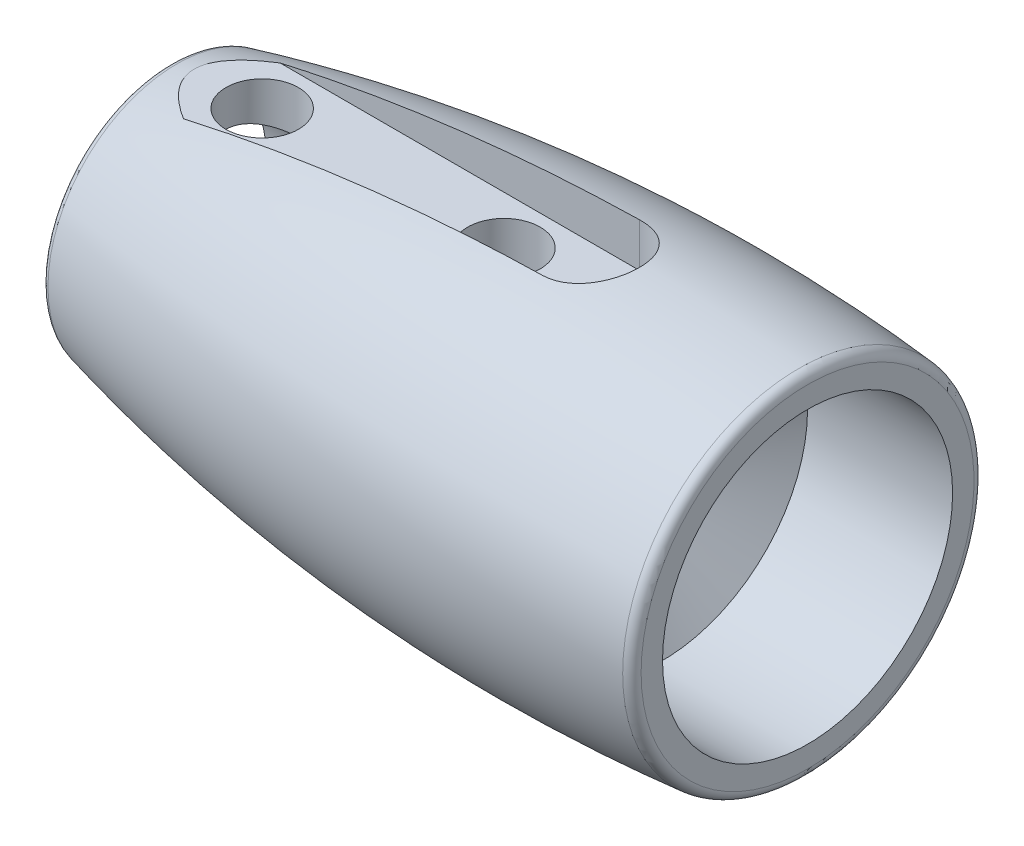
SolidWorks part; units mm, degrees
ref_plane "Plan de face" through (0, 0, 0) normal (0, 0, 1) x (1, 0, 0)
ref_plane "Plan de dessus" through (0, 0, 0) normal (0, 1, 0) x (1, 0, 0)
ref_plane "Plan de droite" through (0, 0, 0) normal (1, 0, 0) x (0, 0, -1)
sketch "Esquisse1" plane through (0, 0, 0) normal (0, 0, 1) x (1, 0, 0)
  line L0 (0, 0) -> (64.5142, 0) construction
  line L1 (8.9334, 6.5625) -> (8.9334, 5)
  line L3 (41.9334, 9.0625) -> (41.9334, 5)
  line L4 (8.9334, 5) -> (41.9334, 5)
  arc A0 (41.9334, 9.0625) -> (8.9334, 6.5625) centre (32.695, -88.0405) ccw
  ellipse E0 centre (32.2571, 0) end of major axis (0, 0) minor radius 9.5 (41.9334, 9.0625) -> (8.9334, 6.5625) ccw construction
  dimension "D1" = 10
  dimension "D2" = 13.125
  dimension "D3" = 18.125
  dimension "D4" = 33
  dimension "D6" = 19
revolve "Révolution1" add sketch "Esquisse1" angle 360 about L0
ref_plane "Plan1" through (0, 6.875, 0) normal (0, 1, 0) x (-1, 0, 0)
sketch "Esquisse7" plane through (0, 6.875, 0) normal (0, 1, 0) x (-1, 0, 0)
  line L0 (-30.7334, 0) -> (-5.7334, 0) construction
  line L1 (-30.7334, 2.5) -> (-5.7334, 2.5)
  line L2 (-30.7334, -2.5) -> (-5.7334, -2.5)
  line L6 (-8.9334, -6.5625) -> (-8.9334, 6.5625) construction
  arc A0 (-30.7334, 2.5) -> (-30.7334, -2.5) centre (-30.7334, 0) ccw
  arc A1 (-5.7334, -2.5) -> (-5.7334, 2.5) centre (-5.7334, 0) ccw
  point P3 (-18.2334, 0)
  dimension "D1" = 2.5
  dimension "D2" = 21.8
  dimension "D3" = 25
extrude "Enlèv. mat.-Extru.1" cut sketch "Esquisse7" along normal through all
hole_wizard "Diamètre du perçage Ø3.7 (3.7)2" positions "Esquisse9" profile "Esquisse8" hole size "Ø3.7" standard "Ansi Metric"
sketch "Esquisse9" plane through (0, 6.875, 0) normal (0, 1, 0) x (-1, 0, 0)
  line L0 (-2.4772, 0) -> (-30.7334, 0) construction
  point P0 (-26.2334, 0)
  point P1 (-13.7334, 0)
  dimension "D1" = 4.5
  dimension "D2" = 12.5
sketch "Esquisse8" plane through (26.2334, 6.875, 0) normal (1, 0, 0) x (0, 0, 1)
  line L0 (0, 0) -> (0, 7.1266)
  line L1 (0, 7.1266) -> (1.875, 6)
  line L2 (1.875, 6) -> (1.875, 0)
  line L5 (1.875, 0) -> (0, 0)
  line L10 (0, 7.1266) -> (-1.875, 6) construction
  line L11 (0, -6.35) -> (0, 107.95) construction
  dimension "Diamètre du perçage" = 3.75
  dimension "Profondeur du perçage" = 6
  dimension "Angle de pointe" = 118
fillet "Congé3" radius 0.5 2 edges at (41.9334, 0, 9.0625) (8.9334, 0, 6.5625)
hole_wizard "Diamètre du perçage Ø15.0 (15)1" positions "Esquisse11" profile "Esquisse10" hole size "Ø15.0" standard "Ansi Metric"
sketch "Esquisse11" plane through (41.9334, 0, 0) normal (1, 0, 0) x (0, 0, -1)
  circle A0 centre (0, 0) radius 5 construction
  point P0 (0, 0)
sketch "Esquisse10" plane through (41.9334, 0, 0) normal (0, 1, 0) x (0, 0, -1)
  line L0 (0, 0) -> (0, 12.0065)
  line L1 (0, 12.0065) -> (7.5, 7.5)
  line L2 (7.5, 7.5) -> (7.5, 0)
  line L5 (7.5, 0) -> (0, 0)
  line L10 (0, 12.0065) -> (-7.5, 7.5) construction
  line L11 (0, -6.35) -> (0, 107.95) construction
  dimension "Diamètre du perçage" = 15
  dimension "Profondeur du perçage" = 7.5
  dimension "Angle de pointe" = 118
